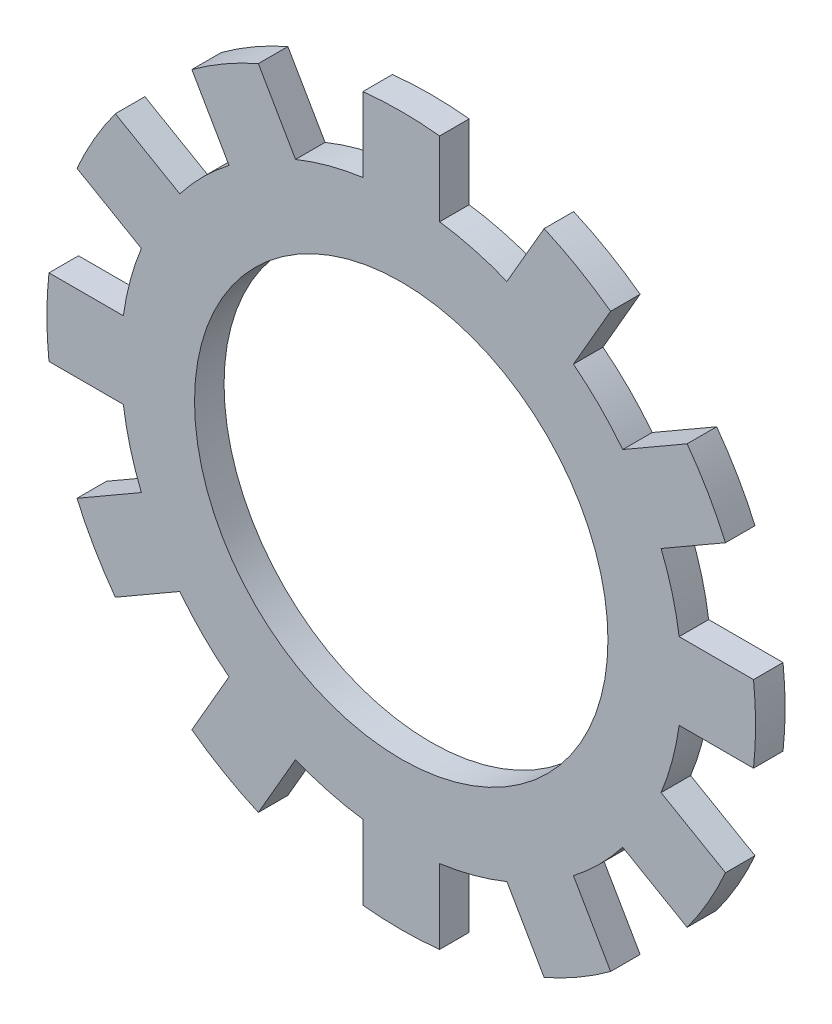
SolidWorks part; units mm, degrees
ref_plane "Front Plane" through (0, 0, 0) normal (0, 0, 1) x (1, 0, 0)
ref_plane "Top Plane" through (0, 0, 0) normal (0, 1, 0) x (1, 0, 0)
ref_plane "Right Plane" through (0, 0, 0) normal (1, 0, 0) x (0, 0, -1)
sketch "Sketch1" plane through (0, 0, 0) normal (0, 0, 1) x (1, 0, 0)
  circle A0 centre (0, 0) radius 7
  circle A1 centre (0, 0) radius 9.5
  dimension "D1" = 14
  dimension "D2" = 19
extrude "Boss-Extrude1" add sketch "Sketch1" along normal mid plane 1
sketch "Sketch2" plane through (0, 0, 0) normal (0, 0, 1) x (1, 0, 0)
  line L0 (0, 2.6811) -> (0, -2.8425) construction
sketch "Sketch3" plane through (0, 0, 0) normal (0, 0, 1) x (1, 0, 0)
  line L0 (-1.3, 11.9294) -> (-1.3, 9.4106)
  line L2 (0, 2.6811) -> (0, -2.8425) construction
  line L3 (0, 9.5) -> (0, 12)
  arc A0 (0, 12) -> (-1.3, 11.9294) centre (0, 0) ccw
  arc A1 (0, 9.5) -> (-1.3, 9.4106) centre (0, 0) ccw
  circle A2 centre (0, 0) radius 9.5 construction
  dimension "D2" = 12
  dimension "D1" = 1.3
extrude "Boss-Extrude2" add sketch "Sketch3" along normal mid plane 1
mirror "Mirror1" about plane through (0, 0, 0) normal (1, 0, 0) of "Boss-Extrude2"
pattern_circular "CirPattern2" count 12 over 360 about axis through (0, 0, 0) along (0, 0, 1) of "Boss-Extrude2", "Mirror1"
